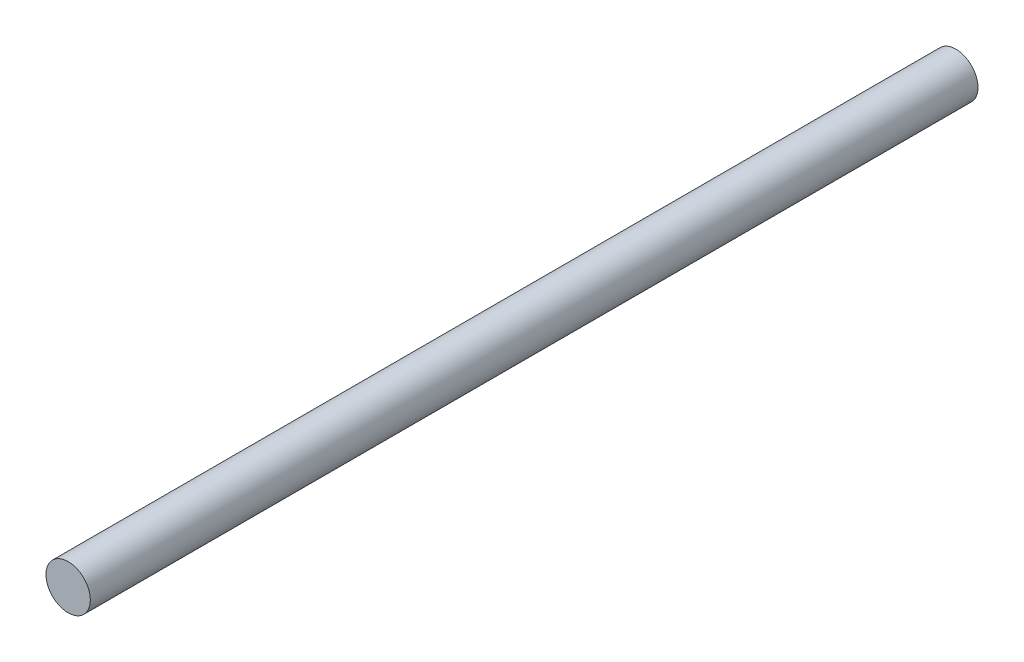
SolidWorks part; units mm, degrees
ref_plane "Front Plane" through (0, 0, 0) normal (0, 0, 1) x (1, 0, 0)
ref_plane "Top Plane" through (0, 0, 0) normal (0, 1, 0) x (1, 0, 0)
ref_plane "Right Plane" through (0, 0, 0) normal (1, 0, 0) x (0, 0, -1)
sketch "Sketch1" plane through (0, 0, 0) normal (0, 0, 1) x (1, 0, 0)
  circle A0 centre (0, 0) radius 1.016
  dimension "D1" = 2.032
extrude "Boss-Extrude1" add sketch "Sketch1" along normal blind 40.64
